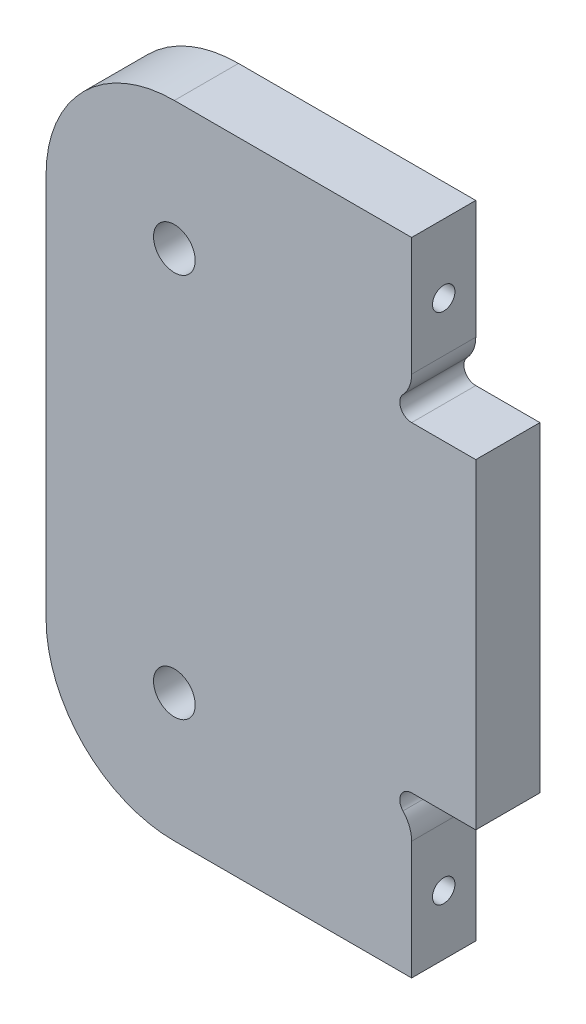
SolidWorks part; units mm, degrees
ref_plane "Plan de face" through (0, 0, 0) normal (0, 0, 1) x (1, 0, 0)
ref_plane "Plan de dessus" through (0, 0, 0) normal (0, 1, 0) x (1, 0, 0)
ref_plane "Plan de droite" through (0, 0, 0) normal (1, 0, 0) x (0, 0, -1)
sketch "Esquisse1" plane through (0, 0, 0) normal (0, 0, 1) x (1, 0, 0)
  line L0 (22.6472, -24.3058) -> (32.6472, -24.3058)
  line L1 (32.6472, -24.3058) -> (32.6472, 25.6942)
  line L2 (32.6472, 25.6942) -> (22.6472, 25.6942)
  line L3 (22.6472, 32.2264) -> (22.6472, 50.6942)
  line L4 (22.6472, 50.6942) -> (-14.3528, 50.6942)
  line L5 (-34.3528, 30.6942) -> (-34.3528, -29.3058)
  line L6 (-14.3528, -49.3058) -> (22.6472, -49.3058)
  line L7 (22.6472, -49.3058) -> (22.6472, -30.8379)
  arc A0 (22.6472, -30.8379) -> (21.2968, -27.4203) centre (17.6472, -30.8379) ccw
  arc A1 (22.6472, -24.3058) -> (21.2968, -27.4203) centre (22.6472, -26.1558) ccw
  arc A2 (21.2968, 28.8087) -> (22.6472, 25.6942) centre (22.6472, 27.5442) ccw
  arc A3 (21.2968, 28.8087) -> (22.6472, 32.2264) centre (17.6472, 32.2264) ccw
  arc A4 (-14.3528, 50.6942) -> (-34.3528, 30.6942) centre (-14.3528, 30.6942) ccw
  arc A5 (-34.3528, -29.3058) -> (-14.3528, -49.3058) centre (-14.3528, -29.3058) ccw
  circle A6 centre (-14.3528, -29.3058) radius 3.25
  circle A7 centre (-14.3528, 30.6942) radius 3.25
  point P22 (22.6472, -40.0719)
  dimension "D5" = 6.5
  dimension "D6" = 6.5
  dimension "D1" = 57
  dimension "D2" = 57
  dimension "D3" = 60
  dimension "D4" = 10
extrude "Boss.-Extru.1" add sketch "Esquisse1" along normal blind 10
hole_wizard "Diamètre du perçage Ø3.5 (3.5)1" positions "Esquisse2" profile "Esquisse3" hole size "Ø3.5" standard "ISO"
sketch "Esquisse2" plane through (22.6472, 0, 0) normal (1, 0, 0) x (0, 0, -1)
  line L1 (55, 0) -> (-55, 0) construction
  line L2 (0, 32.2264) -> (0, 50.6942) construction
  line L3 (0, -49.3058) -> (0, -30.8379) construction
  point P0 (-5, 40)
  point P2 (-5, -40.0022)
  dimension "D1" = 40.0022
  dimension "D2" = 40
  dimension "D3" = 5
  dimension "D4" = 5
sketch "Esquisse3" plane through (22.6472, 40, 5) normal (0, 1, 0) x (0, 0, -1)
  line L0 (0, 0) -> (0, 15.0515)
  line L1 (0, 15.0515) -> (1.75, 14)
  line L2 (1.75, 14) -> (1.75, 0)
  line L5 (1.75, 0) -> (0, 0)
  line L10 (0, 15.0515) -> (-1.75, 14) construction
  line L11 (0, -6.35) -> (0, 107.95) construction
  dimension "Diamètre du perçage" = 3.5
  dimension "Profondeur du perçage" = 14
  dimension "Angle de pointe" = 118
